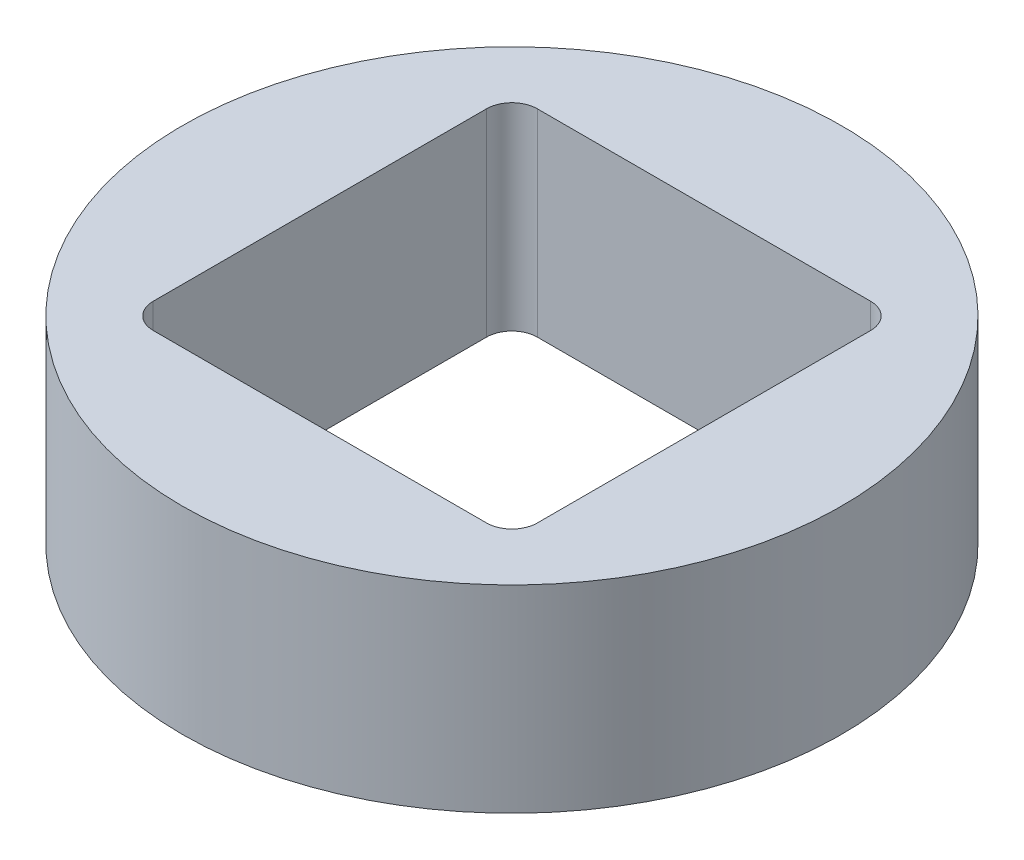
SolidWorks part; units mm, degrees
ref_plane "Front Plane" through (0, 0, 0) normal (0, 0, 1) x (1, 0, 0)
ref_plane "Top Plane" through (0, 0, 0) normal (0, 1, 0) x (1, 0, 0)
ref_plane "Right Plane" through (0, 0, 0) normal (1, 0, 0) x (0, 0, -1)
sketch "Sketch1" plane through (0, 0, 0) normal (0, 1, 0) x (1, 0, 0)
  line L1 (13.15, -15.15) -> (-13.15, -15.15)
  line L2 (15.15, -13.15) -> (15.15, 13.15)
  line L3 (13.15, 15.15) -> (-13.15, 15.15)
  line L4 (-15.15, -13.15) -> (-15.15, 13.15)
  line L5 (15.15, -15.15) -> (-15.15, 15.15) construction
  line L6 (15.15, 15.15) -> (-15.15, -15.15) construction
  circle A0 centre (0, 0) radius 26
  arc A1 (13.15, -15.15) -> (15.15, -13.15) centre (13.15, -13.15) ccw
  arc A2 (-13.15, -15.15) -> (-15.15, -13.15) centre (-13.15, -13.15) cw
  arc A3 (15.15, 13.15) -> (13.15, 15.15) centre (13.15, 13.15) ccw
  arc A4 (-13.15, 15.15) -> (-15.15, 13.15) centre (-13.15, 13.15) ccw
  dimension "D1" = 52
  dimension "D4" = 2
  dimension "D2" = 30.3
  dimension "D3" = 30.3
extrude "Boss-Extrude1" add sketch "Sketch1" along normal blind 15.6
